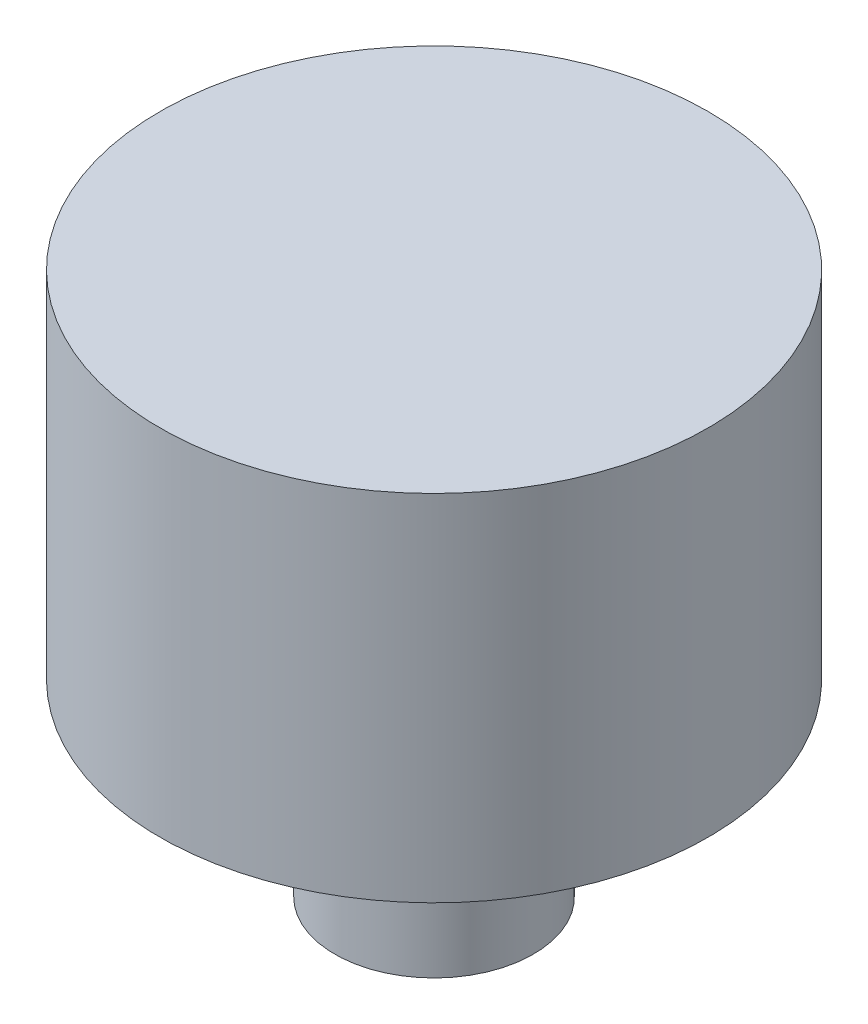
SolidWorks part; units mm, degrees
ref_plane "Front" through (0, 0, 0) normal (0, 0, 1) x (1, 0, 0)
ref_plane "Top" through (0, 0, 0) normal (0, 1, 0) x (1, 0, 0)
ref_plane "Right" through (0, 0, 0) normal (1, 0, 0) x (0, 0, -1)
sketch "Sketch1" plane through (0, 0, 0) normal (0, 1, 0) x (1, 0, 0)
  circle A0 centre (0, 0) radius 27.6
  dimension "D1" = 55.2
extrude "Boss-Extrude1" add sketch "Sketch1" along normal mid plane 35.7
sketch "Sketch2" plane through (0, -17.85, 0) normal (0, -1, 0) x (1, 0, 0)
  circle A0 centre (0, 0) radius 10
  dimension "D1" = 20
extrude "Boss-Extrude2" add sketch "Sketch2" along normal blind 19
